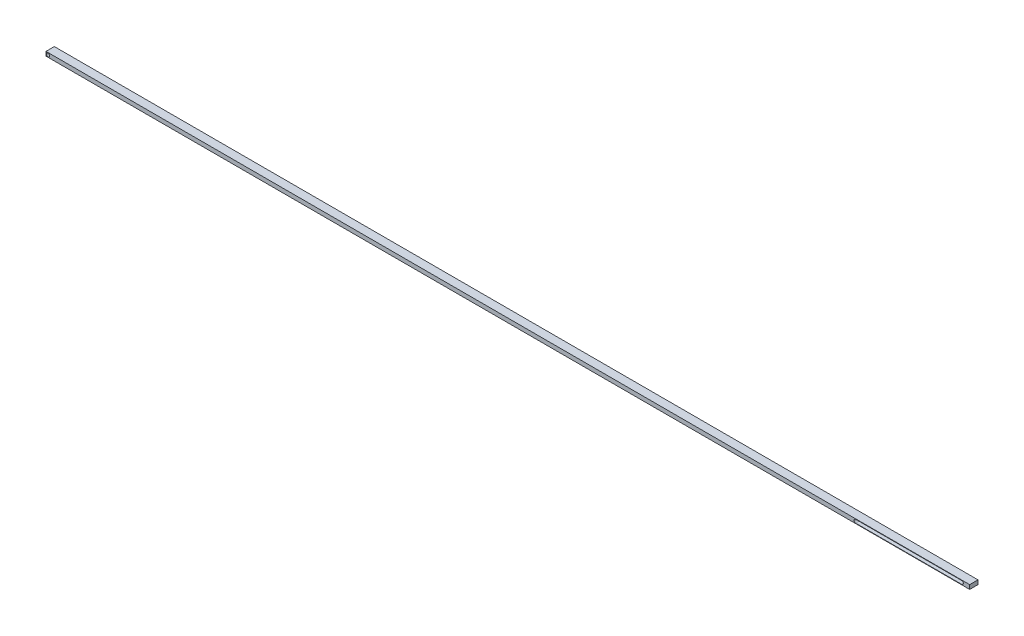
SolidWorks part; units mm, degrees
ref_plane "Ebene vorne" through (0, 0, 0) normal (0, 0, 1) x (1, 0, 0)
ref_plane "Ebene oben" through (0, 0, 0) normal (0, 1, 0) x (1, 0, 0)
ref_plane "Ebene rechts" through (0, 0, 0) normal (1, 0, 0) x (0, 0, -1)
sketch "Skizze1" plane through (0, 0, 0) normal (0, 0, 1) x (1, 0, 0)
  line L1 (0, 0) -> (2220, 0)
  line L2 (0, 0) -> (0, 10)
  line L3 (0, 10) -> (2220, 10)
  line L4 (2220, 0) -> (2220, 10)
  dimension "D1" = 2220
  dimension "D2" = 10
extrude "Aufsatz-Linear austragen1" add sketch "Skizze1" along normal blind 20
sketch "Skizze2" plane through (0, 0, 20) normal (0, 0, 1) x (1, 0, 0)
  line L0 (0, 10) -> (0, 0) construction
  line L1 (0, 0) -> (2220, 0) construction
  circle A0 centre (5, 5) radius 4
  dimension "D1" = 8
  dimension "D2" = 5
  dimension "D3" = 5
extrude "Schnitt-Linear austragen1" cut sketch "Skizze2" against normal through all
sketch "Skizze3" plane through (0, 0, 20) normal (0, 0, 1) x (1, 0, 0)
  line L0 (2201, 5) -> (1946, 5) construction
  line L1 (2201, 1) -> (1946, 1)
  line L2 (2201, 9) -> (1946, 9)
  line L3 (0, 0) -> (2220, 0) construction
  line L5 (2220, 0) -> (2220, 10) construction
  arc A0 (2201, 1) -> (2201, 9) centre (2201, 5) ccw
  arc A1 (1946, 9) -> (1946, 1) centre (1946, 5) ccw
  point P2 (2073.5, 5)
  dimension "D1" = 4
  dimension "D2" = 1
  dimension "D3" = 255
  dimension "D4" = 19
extrude "Schnitt-Linear austragen2" cut sketch "Skizze3" against normal through all
